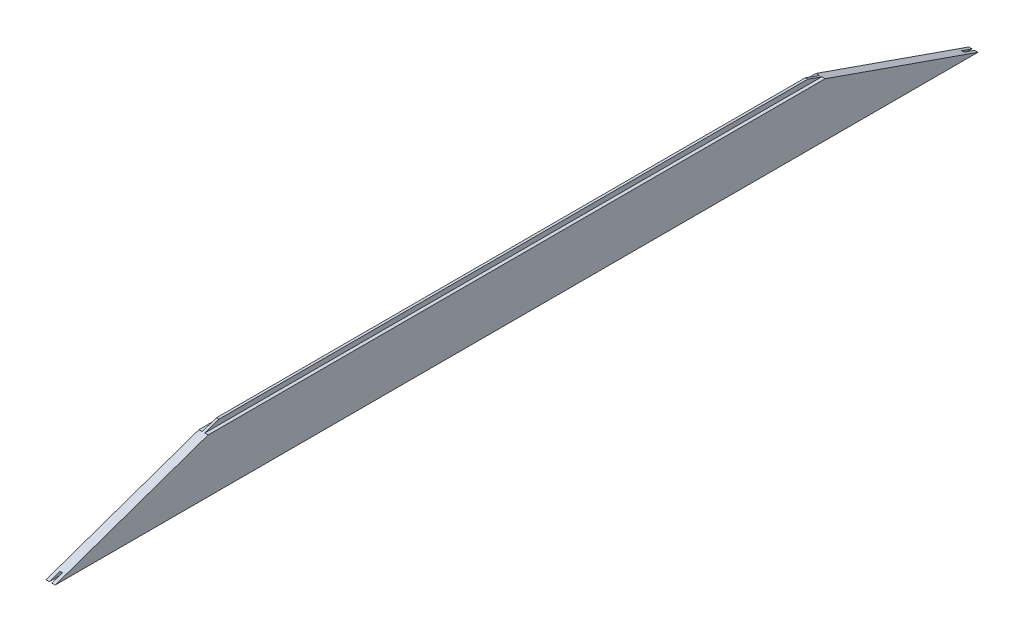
SolidWorks part; units mm, degrees
ref_plane "Plan de face" through (0, 0, 0) normal (0, 0, 1) x (1, 0, 0)
ref_plane "Plan de dessus" through (0, 0, 0) normal (0, 1, 0) x (1, 0, 0)
ref_plane "Plan de droite" through (0, 0, 0) normal (1, 0, 0) x (0, 0, -1)
sketch "Esquisse1" plane through (0, 0, 0) normal (0, 0, 1) x (1, 0, 0)
  line L1 (-7.5, 43.5) -> (7.5, 43.5)
  line L2 (-7.5, 43.5) -> (-7.5, -43.5)
  line L3 (-7.5, -43.5) -> (7.5, -43.5)
  line L4 (7.5, 43.5) -> (7.5, -43.5)
  line L5 (-7.5, 43.5) -> (7.5, -43.5) construction
  line L6 (-7.5, -43.5) -> (7.5, 43.5) construction
  line L7 (-2, 51.5) -> (2, 51.5)
  line L8 (-2, 51.5) -> (-2, 35.5)
  line L9 (-2, 35.5) -> (2, 35.5)
  line L10 (2, 51.5) -> (2, 35.5)
  line L11 (-2, 51.5) -> (2, 35.5) construction
  line L12 (-2, 35.5) -> (2, 51.5) construction
  line L13 (-2, -37.5) -> (2, -37.5)
  line L14 (-2, -37.5) -> (-2, -49.5)
  line L15 (-2, -49.5) -> (2, -49.5)
  line L16 (2, -37.5) -> (2, -49.5)
  line L17 (-2, -37.5) -> (2, -49.5) construction
  line L18 (-2, -49.5) -> (2, -37.5) construction
  point P0 (0, 0)
  point P5 (0, 43.5)
  point P11 (0, -43.5)
  dimension "D1" = 15
  dimension "D2" = 87
  dimension "D3" = 4
  dimension "D4" = 16
  dimension "D5" = 4
  dimension "D6" = 12
extrude "Boss.-Extru.1" add sketch "Esquisse1" along normal blind 1500 contours L13 L16 L3 L4 L1 L10 L9 L8 L2 L14 | L10 L1 L8 L9 | L10 L7 L8 L1
sketch "Esquisse2" plane through (0, 0, 0) normal (1, 0, 0) x (0, 0, -1)
  line L0 (-1500, -43.5) -> (0, -43.5) construction
  line L1 (-1500, -43.5) -> (-1440.4636, -22.6623)
  line L2 (-1500, -43.5) -> (-1228.5707, 51.5)
  line L3 (-1500, 51.5) -> (0, 51.5) construction
  line L4 (-1228.5707, 51.5) -> (-1500, 51.5)
  line L5 (-1500, 51.5) -> (-1500, -43.5)
  line L6 (0, -43.5) -> (-99.8109, -8.5663)
  line L7 (0, -43.5) -> (-271.4293, 51.5)
  line L8 (-271.4293, 51.5) -> (0, 51.5)
  line L9 (0, 51.5) -> (0, -43.5)
  arc A0 (-1436.9224, -43.5) -> (-1440.4636, -22.6623) centre (-1500, -43.5) ccw
  arc A1 (-105.7478, -43.5) -> (-99.8109, -8.5663) centre (0, -43.5) cw
extrude "Enlèv. mat.-Extru.1" cut sketch "Esquisse2" against normal through all both and the other way through all contours L2 L4 L5 | L7 L8 L9
